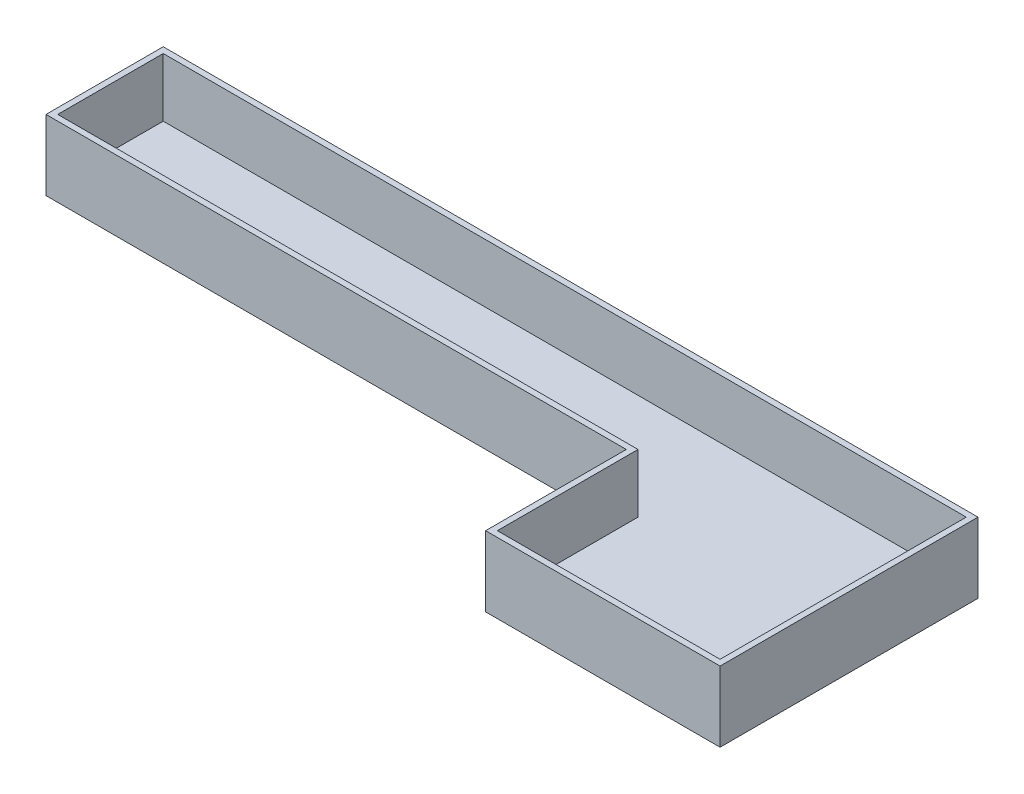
SolidWorks part; units mm, degrees
ref_plane "Front Plane" through (0, 0, 0) normal (0, 0, 1) x (1, 0, 0)
ref_plane "Top Plane" through (0, 0, 0) normal (0, 1, 0) x (1, 0, 0)
ref_plane "Right Plane" through (0, 0, 0) normal (1, 0, 0) x (0, 0, -1)
sketch "Sketch1" plane through (0, 0, 0) normal (0, 1, 0) x (1, 0, 0)
  line L0 (0, 0) -> (0, 254)
  line L1 (0, 254) -> (1765.3, 254)
  line L2 (1765.3, 254) -> (1765.3, -304.8)
  line L3 (1765.3, -304.8) -> (1257.3, -304.8)
  line L4 (1257.3, -304.8) -> (1257.3, 0)
  line L5 (1257.3, 0) -> (0, 0)
  dimension "D1" = 558.8
  dimension "D2" = 1765.3
  dimension "D3" = 508
  dimension "D4" = 304.8
extrude "Boss-Extrude1" add sketch "Sketch1" along normal mid plane 152.4 contours L1 L2 L3 L4 L5 L0
sketch "Sketch2" plane through (0, 76.2, 0) normal (0, 1, 0) x (1, 0, 0)
  line L0 (12.7, 12.7) -> (12.7, 241.3)
  line L1 (12.7, 241.3) -> (1752.6, 241.3)
  line L2 (1752.6, 241.3) -> (1752.6, -292.1)
  line L3 (1752.6, -292.1) -> (1270, -292.1)
  line L6 (0, 0) -> (0, 254) construction
  line L7 (0, 254) -> (1765.3, 254) construction
  line L8 (1765.3, 254) -> (1765.3, -304.8) construction
  line L9 (1765.3, -304.8) -> (1257.3, -304.8) construction
  line L11 (1270, -292.1) -> (1270, 12.7)
  line L12 (12.7, 12.7) -> (1270, 12.7)
  line L13 (1257.3, -304.8) -> (1257.3, 0) construction
  line L14 (1257.3, 0) -> (0, 0) construction
  dimension "D1" = 12.7
  dimension "D2" = 12.7
  dimension "D3" = 12.7
  dimension "D4" = 12.7
  dimension "D5" = 12.7
  dimension "D6" = 12.7
extrude "Cut-Extrude1" cut sketch "Sketch2" against normal blind 127
